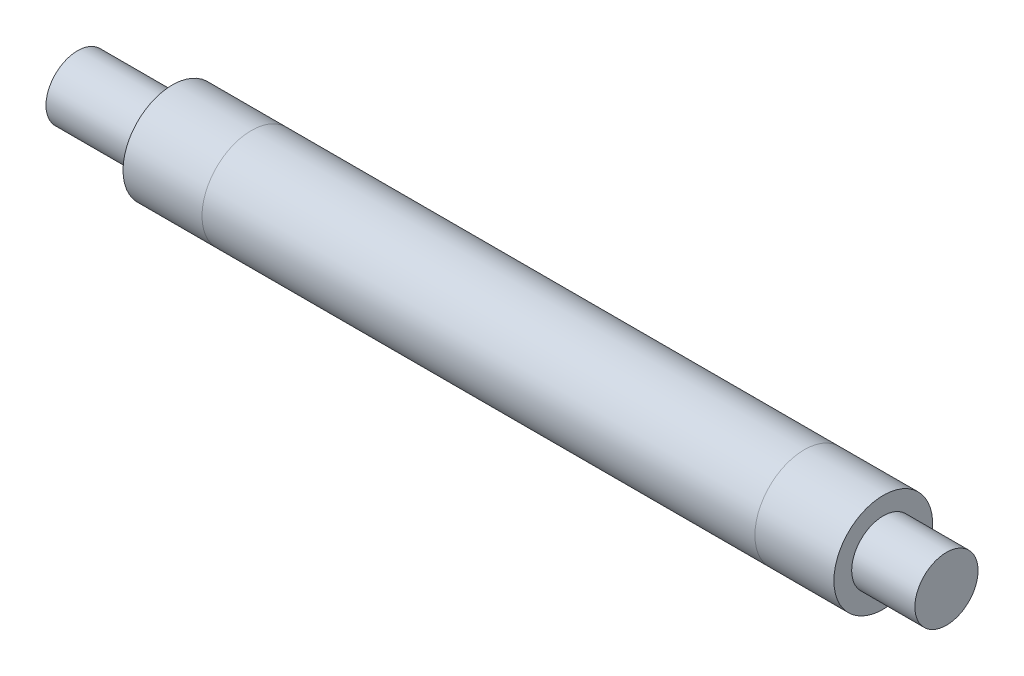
SolidWorks part; units mm, degrees
ref_plane "Front Plane" through (0, 0, 0) normal (0, 0, 1) x (1, 0, 0)
ref_plane "Top Plane" through (0, 0, 0) normal (0, 1, 0) x (1, 0, 0)
ref_plane "Right Plane" through (0, 0, 0) normal (1, 0, 0) x (0, 0, -1)
sketch "Sketch1" plane through (0, 0, 0) normal (0, 0, 1) x (1, 0, 0)
  line L0 (0, 0) -> (69.485, 0) construction
  line L1 (0, 0) -> (0, 2)
  line L2 (0, 2) -> (6, 2)
  line L3 (6, 2) -> (6, 3.125)
  line L4 (6, 3.125) -> (51, 3.125)
  line L5 (51, 3.125) -> (51, 2)
  line L6 (51, 2) -> (55, 2)
  line L7 (55, 2) -> (55, 0)
  line L8 (0, 0) -> (55, 0)
  dimension "D1" = 4
  dimension "D2" = 6.25
  dimension "D3" = 4
  dimension "D4" = 55
  dimension "D5" = 4
  dimension "D6" = 45
revolve "Revolve1" add sketch "Sketch1" angle 360 about L0
sketch "Sketch4" plane through (0, 0, 0) normal (0, 0, 1) x (1, 0, 0)
  line L0 (11, 6.1595) -> (11, -11.6029)
  line L1 (6, 3.125) -> (6, -3.125) construction
  line L2 (56, 7.21) -> (56, -10.9344)
  line L3 (51, -3.125) -> (51, 3.125) construction
  dimension "D1" = 5
  dimension "D2" = 5
sketch "Sketch5" plane through (0, 0, 0) normal (0, 0, 1) x (1, 0, 0)
  line L0 (46, 9.0724) -> (46, -14.5158)
  line L1 (51, -3.125) -> (51, 3.125) construction
  dimension "D1" = 5
